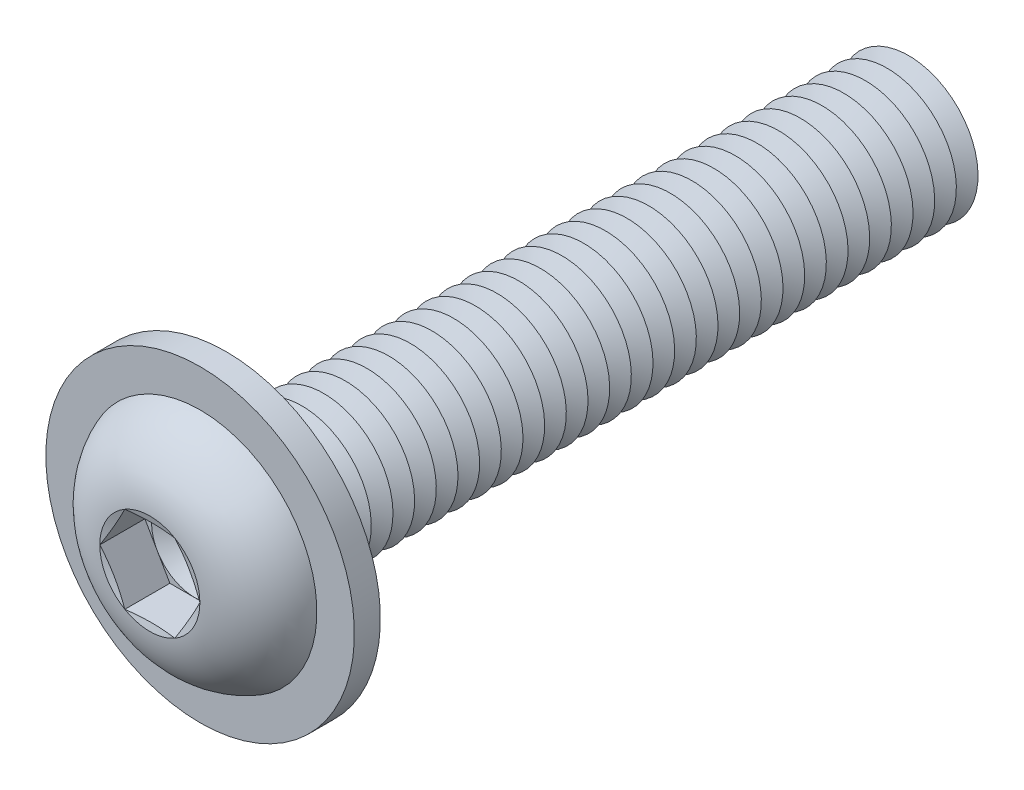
SolidWorks part; units mm, degrees
ref_plane "Front Plane" through (0, 0, 0) normal (0, 0, 1) x (1, 0, 0)
ref_plane "Top Plane" through (0, 0, 0) normal (0, 1, 0) x (1, 0, 0)
ref_plane "Right Plane" through (0, 0, 0) normal (1, 0, 0) x (0, 0, -1)
sketch "Sketch1" plane through (0, 0, 0) normal (1, 0, 0) x (0, 0, -1)
  line L0 (0, 4) -> (0, 7)
  line L3 (0, 4) -> (40, 4)
  line L4 (40, 4) -> (40, 0)
  line L5 (40, 0) -> (-4.4, 0) construction
  line L6 (-4.4, 0) -> (40, 0)
  line L7 (-4.4, 2.8867) -> (-4.4, 1.4434) construction
  line L8 (-4.4, 1.4434) -> (-4.4, 0)
  line L9 (-4.4, 2.8867) -> (-4.0132, 1.4434)
  line L10 (-4.0132, 1.4434) -> (-4.4, 1.4434)
  line L11 (40, 0) -> (22.7481, 0) construction
  line L12 (0, 7) -> (-4.4, 7) construction
  arc A1 (0, 7) -> (-4.4, 2.8867) centre (0, 2.59) ccw
  point P8 (40, 2)
  dimension "D1" = 14
  dimension "D2" = 8
  dimension "D3" = 4.4
  dimension "D4" = 5.7735
  dimension "D5" = 40
  dimension "D6" = 15
revolve "Revolve1" add sketch "Sketch1" angle 360 about L5
fillet "Fillet1" radius 0.625 1 edges at (0, 4, 0)
sketch "Sketch2" plane through (0, 0, 0) normal (1, 0, 0) x (0, 0, -1)
  line L0 (39.375, 4) -> (40.625, 4)
  line L1 (40, 4) -> (0.625, 4) construction
  line L2 (40.625, 4) -> (40, 2.9175)
  line L3 (40, -4) -> (40, 4) construction
  line L4 (40, 2.9175) -> (39.375, 4)
  dimension "D1" = 1.25
revolve "Cut-Revolve1" cut sketch "Sketch2" angle 360 about axis through (0, 0, -40) along (0, 0, -1)
pattern_linear "LPattern1" count 32 spacing 1.25 along (0, 0, 1) of "Cut-Revolve1"
sketch "Sketch3" plane through (0, 0, 4.4) normal (0, 0, 1) x (1, 0, 0)
  line L7 (1.4434, 2.5) -> (-1.4434, 2.5)
  line L8 (-1.4434, 2.5) -> (-2.8867, 0)
  line L9 (-2.8867, 0) -> (-1.4434, -2.5)
  line L10 (-1.4434, -2.5) -> (1.4434, -2.5)
  line L11 (1.4434, -2.5) -> (2.8867, 0)
  line L12 (2.8867, 0) -> (1.4434, 2.5)
  circle A0 centre (0, 0) radius 2.5 construction
  circle A3 centre (0, 0) radius 2.8867 construction
extrude "Cut-Extrude1" cut sketch "Sketch3" against normal blind 2.6
sketch "Sketch4" plane through (0, 0, 1.8) normal (0, 0, 1) x (1, 0, 0)
  line L1 (1.4434, 2.5) -> (-1.4434, 2.5) construction
  circle A0 centre (0, 0) radius 2.5
extrude "Cut-Extrude2" cut sketch "Sketch4" against normal through all draft 60
sketch "Sketch5" plane through (0, 0, 0) normal (0, 0, -1) x (-1, 0, 0)
  circle A0 centre (0, 0) radius 8.9
  circle A1 centre (0, 0) radius 4.625
  circle A2 centre (0, 0) radius 4.625 construction
  dimension "D1" = 17.8
extrude "Boss-Extrude1" add sketch "Sketch5" against normal blind 1.5
